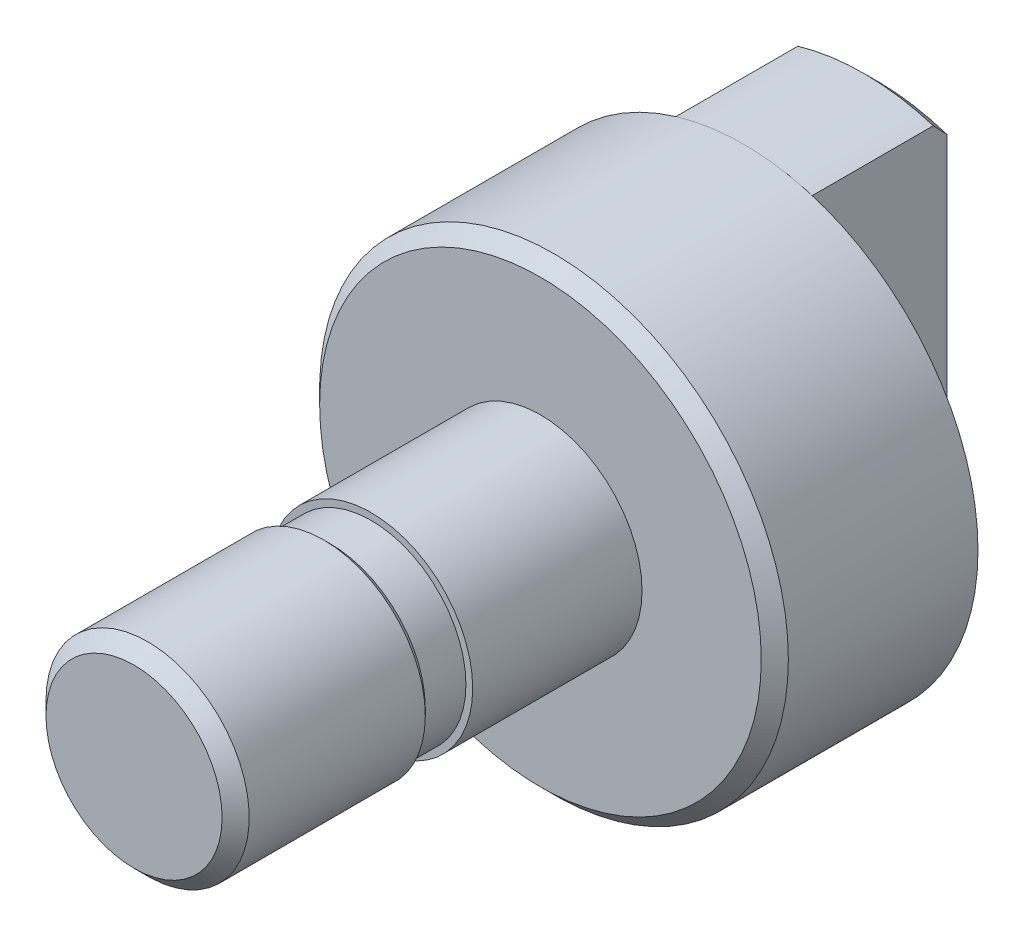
SolidWorks part; units mm, degrees
ref_plane "Front Plane" through (0, 0, 0) normal (0, 0, 1) x (1, 0, 0)
ref_plane "Top Plane" through (0, 0, 0) normal (0, 1, 0) x (1, 0, 0)
ref_plane "Right Plane" through (0, 0, 0) normal (1, 0, 0) x (0, 0, -1)
sketch "Sketch1" plane through (0, 0, 0) normal (0, 0, 1) x (1, 0, 0)
  circle A0 centre (0, 0) radius 21.971
extrude "Boss-Extrude1" add sketch "Sketch1" along normal blind 19.05
sketch "Sketch2" plane through (0, 0, 19.05) normal (0, 0, 1) x (1, 0, 0)
  circle A0 centre (0, 0) radius 9.525
extrude "Boss-Extrude2" add sketch "Sketch2" along normal blind 15.875
sketch "Sketch3" plane through (0, 0, 34.925) normal (0, 0, 1) x (1, 0, 0)
  circle A0 centre (0, 0) radius 8.89
extrude "Boss-Extrude3" add sketch "Sketch3" along normal blind 3.175
sketch "Sketch4" plane through (0, 0, 38.1) normal (0, 0, 1) x (1, 0, 0)
  circle A0 centre (0, 0) radius 9.525
extrude "Boss-Extrude4" add sketch "Sketch4" along normal blind 19.05
chamfer "Chamfer1" distance 1.27 angle 45 1 edges at (21.971, 0, 19.05)
sketch "Sketch5" plane through (0, 0, 0) normal (0, 0, -1) x (-1, 0, 0)
  line L2 (-6.35, -20.9265) -> (-6.35, 20.9265)
  line L4 (6.35, -21.0334) -> (6.35, 21.0334)
  arc A0 (6.35, 21.0334) -> (-6.35, 20.9265) centre (0.1765, 0) ccw
  arc A1 (-6.35, -20.9265) -> (6.35, -21.0334) centre (0.1765, 0) ccw
  circle A2 centre (0, 0) radius 21.971 construction
  point P0 (0, 0)
  dimension "D1" = 6.35
  dimension "D2" = 6.35
extrude "Boss-Extrude5" add sketch "Sketch5" along normal blind 12.7
chamfer "Chamfer2" distance 1.27 angle 45 2 edges at (0.0079, -21.9199, -12.7) (0.0079, 21.9199, -12.7)
chamfer "Chamfer3" distance 1.27 angle 45 2 edges at (9.525, 0, 57.15) (9.525, 0, 38.1)
